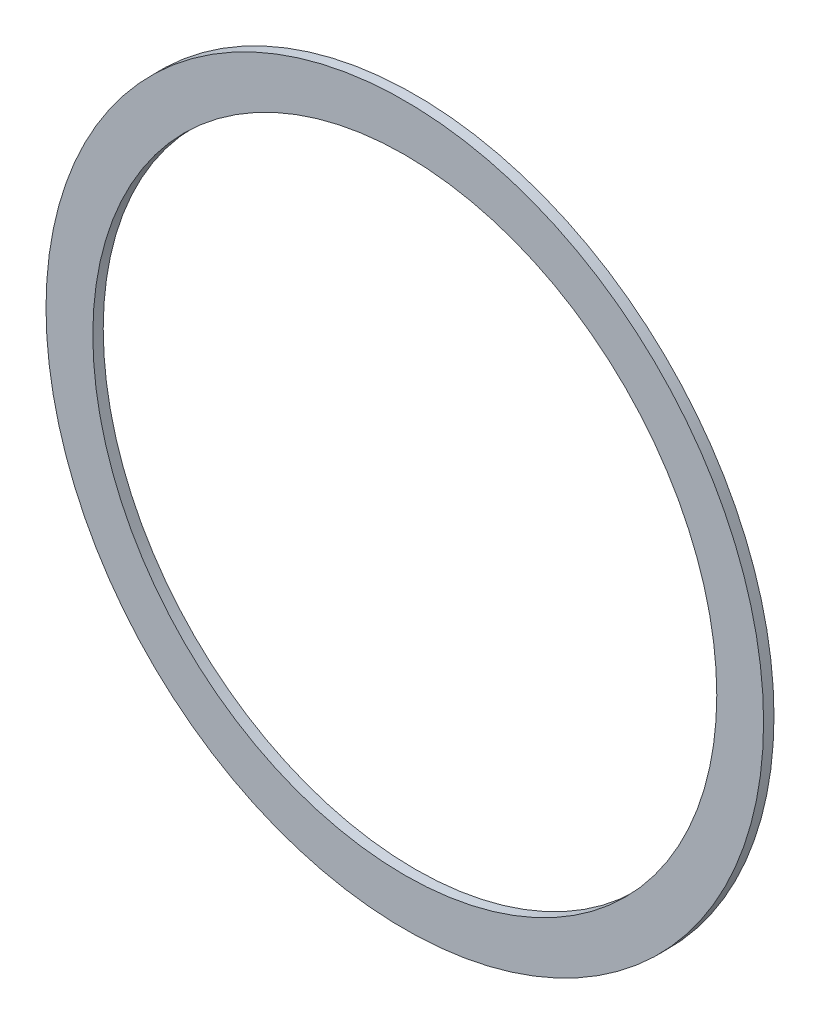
SolidWorks part; units mm, degrees
ref_plane "Front Plane" through (0, 0, 0) normal (0, 0, 1) x (1, 0, 0)
ref_plane "Top Plane" through (0, 0, 0) normal (0, 1, 0) x (1, 0, 0)
ref_plane "Right Plane" through (0, 0, 0) normal (1, 0, 0) x (0, 0, -1)
sketch "Sketch1" plane through (0, 0, 0) normal (0, 0, 1) x (1, 0, 0)
  circle A0 centre (0, 0) radius 69
  circle A1 centre (0, 0) radius 60
  dimension "D1" = 138
  dimension "D2" = 120
extrude "Boss-Extrude1" add sketch "Sketch1" along normal mid plane 2
